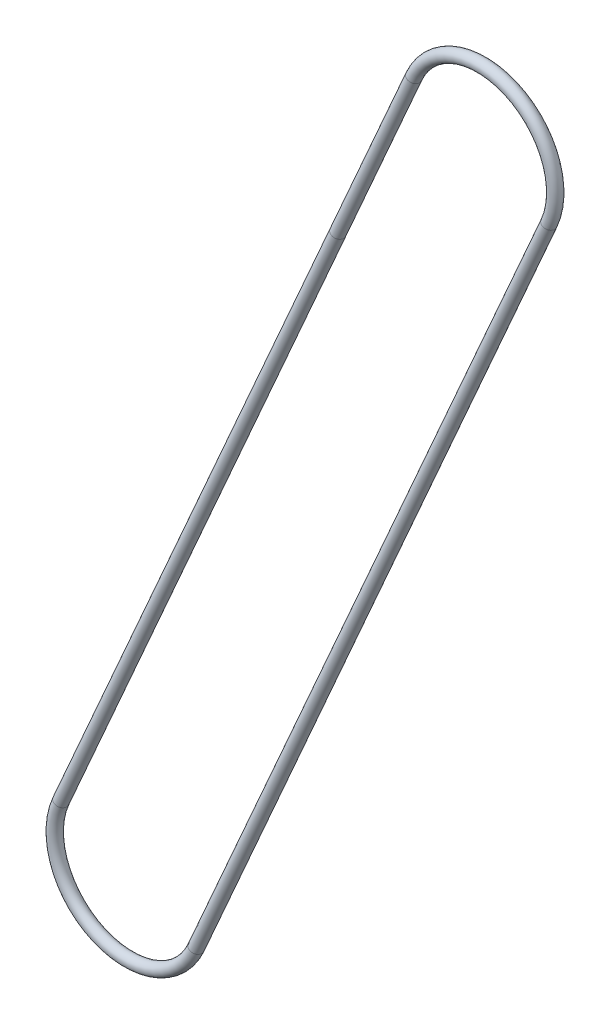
SolidWorks part; units mm, degrees
ref_plane "Front Plane" through (0, 0, 0) normal (0, 0, 1) x (1, 0, 0)
ref_plane "Top Plane" through (0, 0, 0) normal (0, 1, 0) x (1, 0, 0)
ref_plane "Right Plane" through (0, 0, 0) normal (1, 0, 0) x (0, 0, -1)
sketch "Sketch1" plane through (0, 0, 0) normal (0, 0, 1) x (1, 0, 0)
  line L0 (-110.4272, -322.5453) -> (26.1636, -11.4889)
  line L1 (-26.1636, 11.4889) -> (-162.7544, -299.5674)
  circle A0 centre (0, 0) radius 28.575 construction
  circle A1 centre (-136.5908, -311.0563) radius 28.575 construction
  arc A2 (26.1636, -11.4889) -> (-26.1636, 11.4889) centre (0, 0) ccw
  arc A3 (-162.7544, -299.5674) -> (-110.4272, -322.5453) centre (-136.5908, -311.0563) ccw
sketch "Sketch2" plane through (-29.3606, -66.8626, 0) normal (-0.4021, -0.9156, 0) x (0, 0, 1)
  circle A0 centre (0, 28.575) radius 2.3813
  point P0 (0, 28.575)
  dimension "D1" = 4.7625
sweep "Sweep1" add profiles "Sketch2" path "Sketch1"
